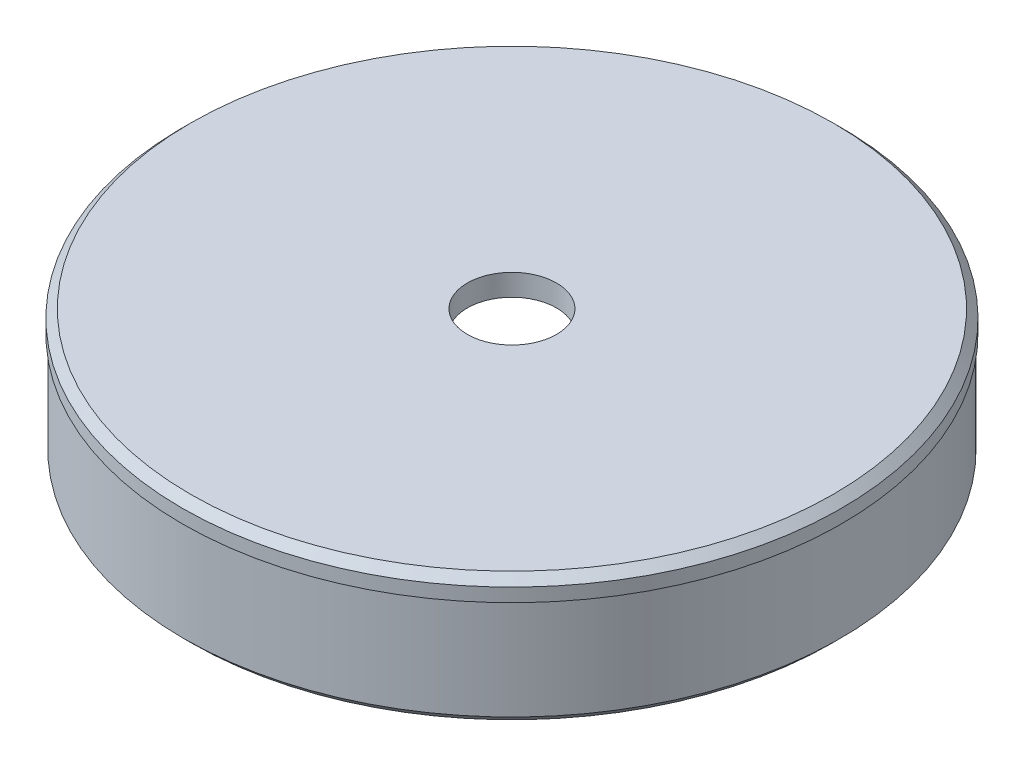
SolidWorks part; units mm, degrees
ref_plane "Front Plane" through (0, 0, 0) normal (0, 0, 1) x (1, 0, 0)
ref_plane "Top Plane" through (0, 0, 0) normal (0, 1, 0) x (1, 0, 0)
ref_plane "Right Plane" through (0, 0, 0) normal (1, 0, 0) x (0, 0, -1)
sketch "Sketch1" plane through (0, 0, 0) normal (0, 1, 0) x (1, 0, 0)
  circle A0 centre (0, 0) radius 7.475
  circle A1 centre (0, 0) radius 10.2
  circle A2 centre (0, 0) radius 12.2
  dimension "D1" = 14.95
  dimension "D2" = 20.4
  dimension "D3" = 24.4
extrude "Boss-Extrude1" add sketch "Sketch1" along normal blind 4 contours A0
sketch "Sketch2" plane through (0, 0, 0) normal (0, 1, 0) x (1, 0, 0)
  circle A0 centre (0, 0) radius 10.15
  circle A1 centre (0, 0) radius 12.15
  dimension "D1" = 20.3
  dimension "D2" = 24.3
extrude "Boss-Extrude2" add sketch "Sketch2" along normal blind 4 separate body
sketch "Sketch3" plane through (0, 4, 0) normal (0, 1, 0) x (1, 0, 0)
  circle A0 centre (0, 0) radius 12.2
extrude "Boss-Extrude3" add sketch "Sketch3" along normal blind 0.8
sketch "Sketch4" plane through (0, 4, 0) normal (0, -1, 0) x (1, 0, 0)
  circle A0 centre (0, 0) radius 8.2947
extrude "Cut-Extrude1" cut sketch "Sketch4" along normal through all
sketch "Sketch5" plane through (0, 4, 0) normal (0, -1, 0) x (1, 0, 0)
  circle A0 centre (0, 0) radius 1.65
  dimension "D1" = 3.3
extrude "Cut-Extrude2" cut sketch "Sketch5" against normal blind 10
chamfer "Chamfer1" distance 0.3 angle 45 4 edges at (0, 4.8, 12.2) (0, 0, 12.15) (0, 4, 10.15) (0, 0, 10.15)
